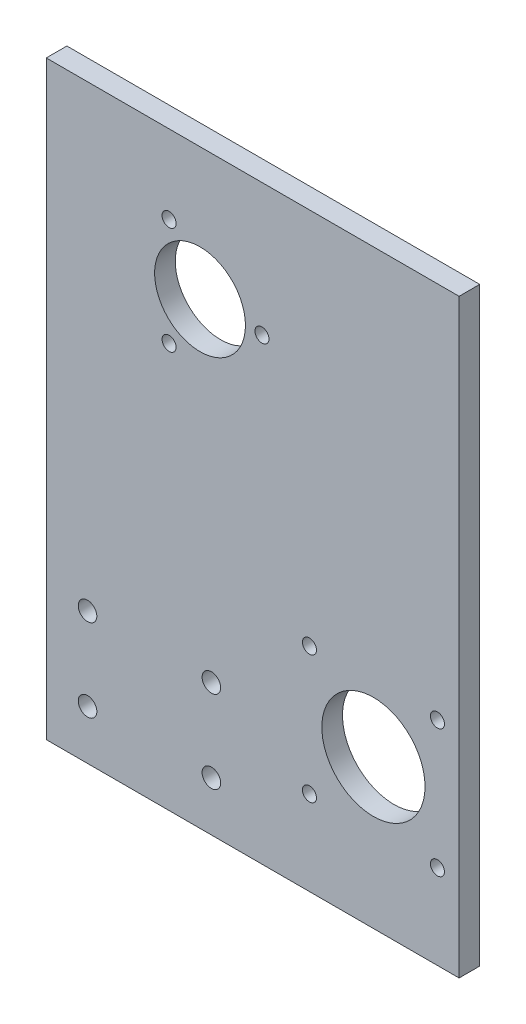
SolidWorks part; units mm, degrees
ref_plane "Piano frontale" through (0, 0, 0) normal (0, 0, 1) x (1, 0, 0)
ref_plane "Piano superiore" through (0, 0, 0) normal (0, 1, 0) x (1, 0, 0)
ref_plane "Piano destro" through (0, 0, 0) normal (1, 0, 0) x (0, 0, -1)
sketch "Schizzo1" plane through (0, 0, 0) normal (0, 0, 1) x (1, 0, 0)
  line L1 (-50, 70) -> (50, 70)
  line L2 (-50, 70) -> (-50, -70)
  line L3 (-50, -70) -> (50, -70)
  line L4 (50, 70) -> (50, -70)
  line L5 (-50, 70) -> (50, -70) construction
  line L6 (-50, -70) -> (50, 70) construction
  point P0 (0, 0)
  dimension "D1" = 100
  dimension "D2" = 140
extrude "Estrusione-Estrusione1" add sketch "Schizzo1" along normal blind 5
hole_wizard "Foro per Vite M4-1" positions "Schizzo3" profile "Schizzo4" hole size "M4" standard "ISO"
sketch "Schizzo3" plane through (0, 0, 5) normal (0, 0, 1) x (1, 0, 0)
  line L0 (-50, -70) -> (50, -70) construction
  point P0 (-40, -38)
  point P2 (-10, -38)
  point P4 (-40, -58)
  point P6 (-10, -58)
  dimension "D1" = 20
  dimension "D2" = 10
  dimension "D3" = 30
  dimension "D4" = 12
sketch "Schizzo4" plane through (-40, -38, 5) normal (1, 0, 0) x (0, -1, 0)
  line L0 (0, 0) -> (0, 5)
  line L1 (0, 5) -> (2.25, 5)
  line L2 (2.25, 5) -> (2.25, 0)
  line L5 (2.25, 0) -> (0, 0)
  line L11 (0, -6.35) -> (0, 107.95) construction
  dimension "Thru Hole Dia." = 4.5
  dimension "Thru Hole Depth" = 5
hole_wizard "Foro per Vite M3-2" positions "Schizzo5" profile "Schizzo6" hole size "M3" standard "ISO"
sketch "Schizzo5" plane through (0, 0, 5) normal (0, 0, 1) x (1, 0, 0)
  line L0 (-50, -70) -> (50, -70) construction
  line L1 (-12.75, 41) -> (-12.75, 63.9107) construction
  line L3 (-12.75, 41) -> (-23.8454, 60.2178) construction
  circle A0 centre (-12.75, 41) radius 15
  point P0 (13.75, -18.5)
  point P2 (44.75, -18.5)
  point P4 (13.75, -49.5)
  point P6 (44.75, -49.5)
  point P8 (-20.25, 53.9904)
  point P44 (2.25, 41)
  point P45 (-20.25, 28.0096)
sketch "Schizzo6" plane through (13.75, -18.5, 5) normal (1, 0, 0) x (0, -1, 0)
  line L0 (0, 0) -> (0, 5)
  line L1 (0, 5) -> (1.7, 5)
  line L2 (1.7, 5) -> (1.7, 0)
  line L5 (1.7, 0) -> (0, 0)
  line L11 (0, -6.35) -> (0, 107.95) construction
  dimension "Thru Hole Dia." = 3.4
  dimension "Thru Hole Depth" = 5
sketch "Schizzo7" plane through (0, 0, 5) normal (0, 0, 1) x (1, 0, 0)
  line L0 (-50, -70) -> (50, -70) construction
  circle A0 centre (-12.75, 41) radius 11
extrude "Taglio-Estrusione1" cut sketch "Schizzo7" against normal through all
sketch "Schizzo8" plane through (0, 0, 5) normal (0, 0, 1) x (1, 0, 0)
  line L0 (-50, -70) -> (50, -70) construction
  circle A0 centre (29.25, -34) radius 12.5
extrude "Taglio-Estrusione2" cut sketch "Schizzo8" against normal through all
sketch "Schizzo13" plane through (0, 70, 0) normal (0, 1, 0) x (1, 0, 0)
  line L1 (-50, 0) -> (50, 0)
  line L2 (-50, 0) -> (-50, -5)
  line L3 (-50, -5) -> (50, -5)
  line L4 (50, 0) -> (50, -5)
extrude "Estrusione-Estrusione3" add sketch "Schizzo13" along normal blind 3
equation "\"D9@Schizzo5\"=27.5/2-1"
equation "\"D3@Schizzo7\"=27.5/2-1"
equation "\"D1@Schizzo5\"=27.5/2"
equation "\"D2@Schizzo8\"=13.75+31/2"
equation "\"D3@Schizzo8\"=14.85+5.65+31/2"
equation "\"D2@Schizzo5\"=14.85+5.65"
